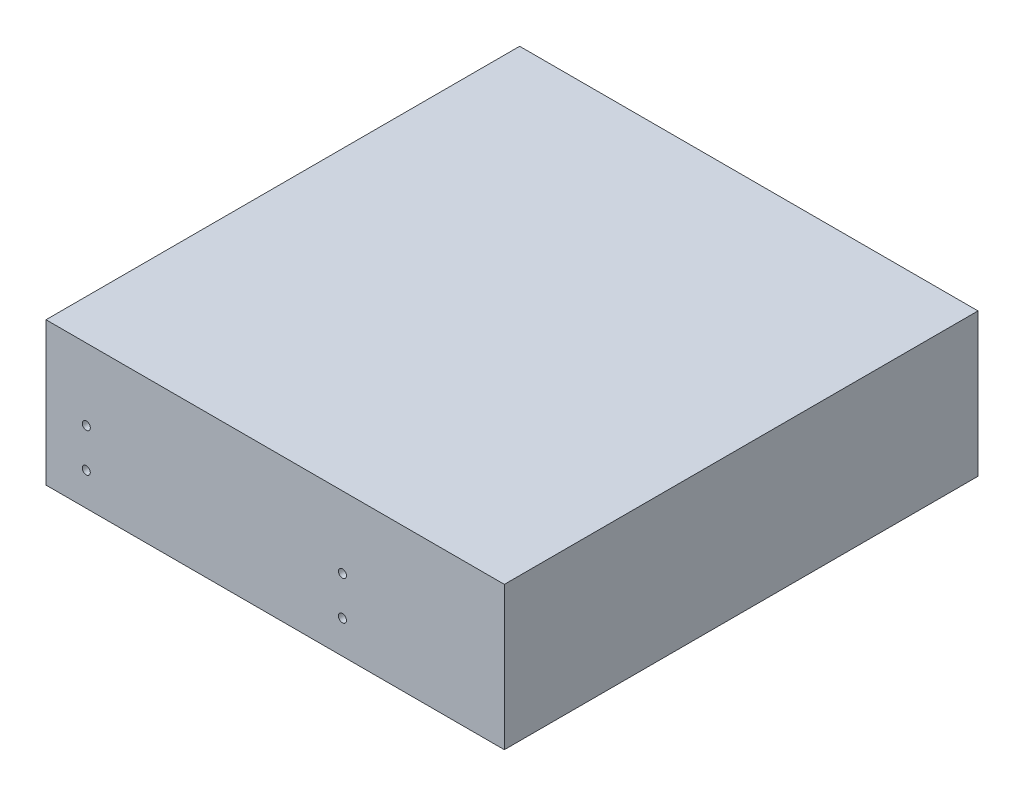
SolidWorks part; units mm, degrees
ref_plane "Front Plane" through (0, 0, 0) normal (0, 0, 1) x (1, 0, 0)
ref_plane "Top Plane" through (0, 0, 0) normal (0, 1, 0) x (1, 0, 0)
ref_plane "Right Plane" through (0, 0, 0) normal (1, 0, 0) x (0, 0, -1)
sketch "Sketch1" plane through (0, 0, 0) normal (0, 0, 1) x (1, 0, 0)
  line L0 (1.25, 0) -> (50.25, 0)
  line L1 (-92, 22.2) -> (50.25, 22.2)
  line L2 (-92, 22.2) -> (-92, -22.25)
  line L3 (-92, -22.25) -> (50.25, -22.25)
  line L4 (50.25, 22.2) -> (50.25, -22.25)
  line L5 (0, -13.25) -> (0, -22.25)
  circle A0 centre (0, 0) radius 1.25
  circle A1 centre (-79.5, 0) radius 1.25
  circle A2 centre (0, -12) radius 1.25
  circle A3 centre (-79.5, -12) radius 1.25
  dimension "D1" = 2.5
  dimension "D2" = 2.5
  dimension "D4" = 2.5
  dimension "D6" = 2.5
  dimension "D3" = 79.5
  dimension "D5" = 12
  dimension "D7" = 12
  dimension "D8" = 79.5
  dimension "D9" = 49
  dimension "D10" = 9
  dimension "D11" = 44.45
  dimension "D12" = 12.5
extrude "Boss-Extrude1" add sketch "Sketch1" along normal blind 147
